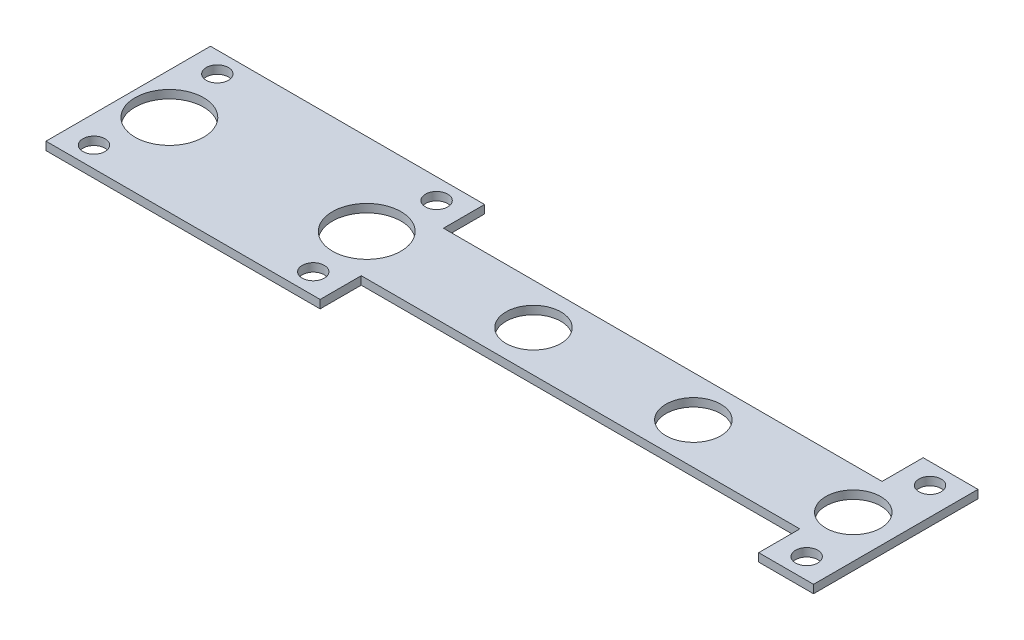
SolidWorks part; units mm, degrees
ref_plane "Piano frontale" through (0, 0, 0) normal (0, 0, 1) x (1, 0, 0)
ref_plane "Piano superiore" through (0, 0, 0) normal (0, 1, 0) x (1, 0, 0)
ref_plane "Piano destro" through (0, 0, 0) normal (1, 0, 0) x (0, 0, -1)
sketch "Schizzo1" plane through (0, 0, 0) normal (0, 1, 0) x (1, 0, 0)
  line L0 (-102.7602, -29.6631) -> (-2.7602, -29.6631)
  line L1 (-2.7602, -29.6631) -> (-2.7602, -14.6631)
  line L2 (-2.7602, -14.6631) -> (157.2398, -14.6631)
  line L3 (157.2398, -14.6631) -> (157.2398, -29.6631)
  line L4 (157.2398, -29.6631) -> (177.2398, -29.6631)
  line L5 (177.2398, -29.6631) -> (177.2398, 30.3369)
  line L6 (177.2398, 30.3369) -> (157.2398, 30.3369)
  line L7 (157.2398, 30.3369) -> (157.2398, 15.3369)
  line L8 (157.2398, 15.3369) -> (-2.7602, 15.3369)
  line L9 (-2.7602, 15.3369) -> (-2.7602, 30.3369)
  line L10 (-2.7602, 30.3369) -> (-102.7602, 30.3369)
  line L11 (-102.7602, 30.3369) -> (-102.7602, -29.6631)
  circle A0 centre (167.2398, -22.1631) radius 4.05
  circle A1 centre (-92.7602, -22.1631) radius 4.05
  circle A2 centre (167.2398, 22.8369) radius 4.05
  circle A3 centre (-92.7602, 22.8369) radius 4.05
  circle A4 centre (-87.7602, 0.3369) radius 12.5
  circle A5 centre (161.7398, 0.3369) radius 10
  circle A6 centre (-15.7602, 0.3369) radius 12.5
  circle A7 centre (-12.7602, -22.1631) radius 4.05
  circle A8 centre (45.0731, 0.3369) radius 10
  circle A9 centre (103.4065, 0.3369) radius 10
  circle A10 centre (-12.7602, 22.8369) radius 4.05
  dimension "D1" = 160
  dimension "D2" = 100
  dimension "D3" = 20
extrude "Estrusione-Estrusione2" add sketch "Schizzo1" along normal blind 3
